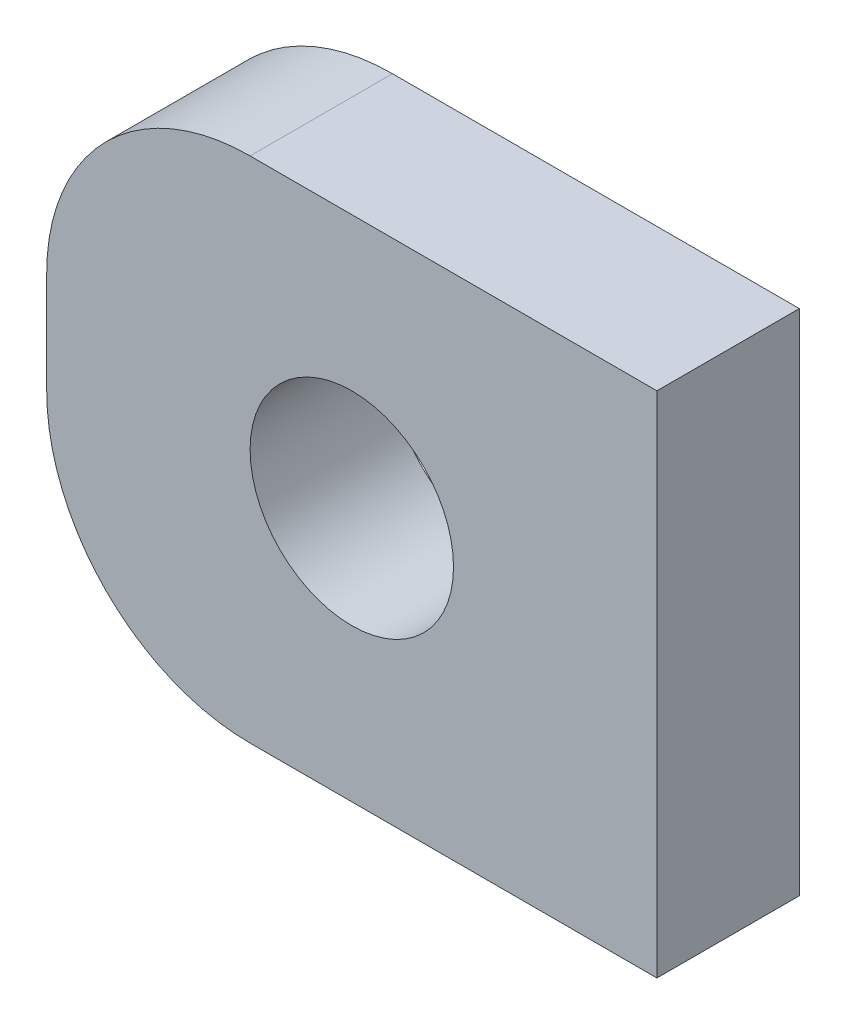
SolidWorks part; units mm, degrees
ref_plane "Front Plane" through (0, 0, 0) normal (0, 0, 1) x (1, 0, 0)
ref_plane "Top Plane" through (0, 0, 0) normal (0, 1, 0) x (1, 0, 0)
ref_plane "Right Plane" through (0, 0, 0) normal (1, 0, 0) x (0, 0, -1)
sketch "Sketch1" plane through (0, 0, 0) normal (0, 0, 1) x (1, 0, 0)
  line L0 (-5, 100) -> (-5, -100) construction
  line L1 (-5, -37.2474) -> (-35, -37.2474)
  line L2 (-5, -37.2474) -> (-5, -12.2474)
  line L3 (-5, -12.2474) -> (-35, -12.2474)
  line L4 (-35, -37.2474) -> (-35, -12.2474)
  dimension "D1" = 30
  dimension "D2" = 25
extrude "Boss-Extrude1" add sketch "Sketch1" against normal mid plane 7
sketch "Sketch2" plane through (0, 0, -3.5) normal (0, 0, -1) x (-1, 0, 0)
  line L0 (35, -12.2474) -> (35, -37.2474) construction
  line L1 (5, -37.2474) -> (5, -12.2474) construction
  circle A0 centre (20, -24.7474) radius 5
  point P4 (35, -24.7474)
  dimension "D1" = 10
  dimension "D2" = 15
extrude "Cut-Extrude1" cut sketch "Sketch2" against normal up to surface (7 mm away)
fillet "Fillet1" radius 10 2 edges at (-35, -12.2474, 0) (-35, -37.2474, 0)
